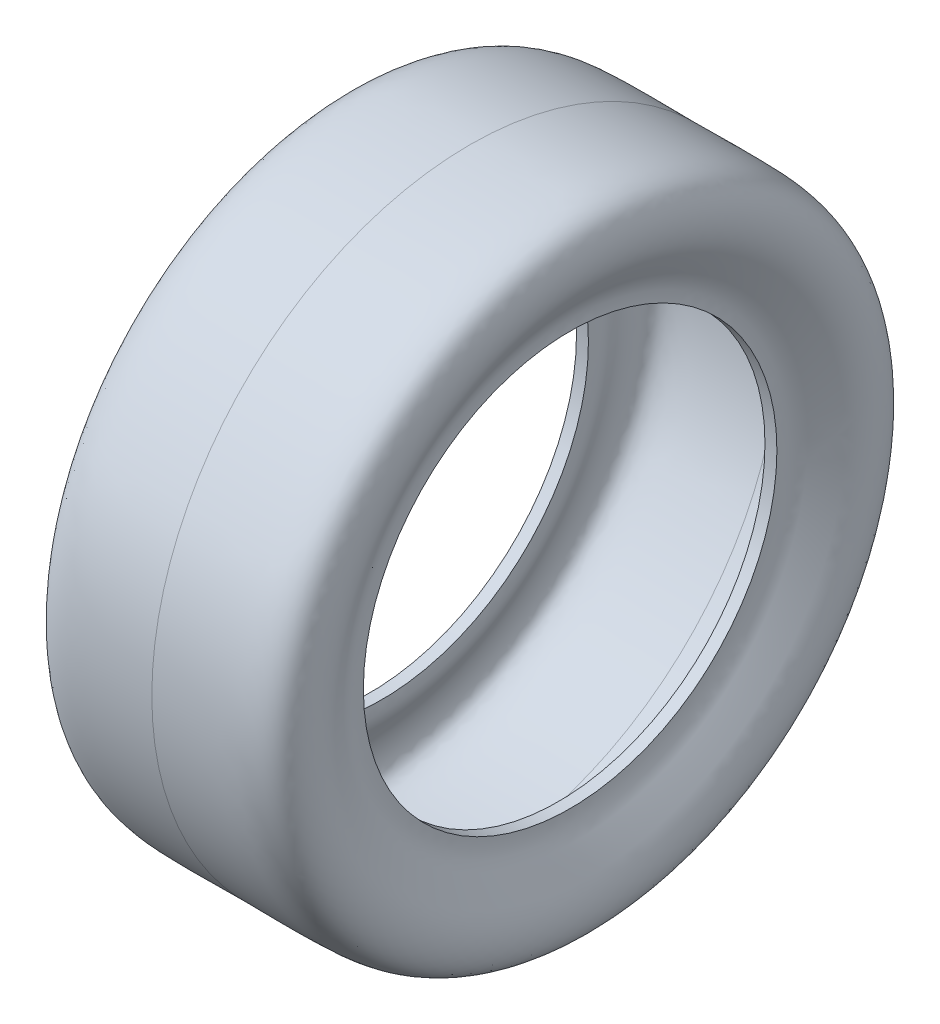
SolidWorks part; units mm, degrees
ref_plane "Front" through (0, 0, 0) normal (0, 0, 1) x (1, 0, 0)
ref_plane "Top" through (0, 0, 0) normal (0, 1, 0) x (1, 0, 0)
ref_plane "Right" through (0, 0, 0) normal (1, 0, 0) x (0, 0, -1)
sketch "Sketch1" plane through (0, 0, 0) normal (0, 0, 1) x (1, 0, 0)
  line L0 (0, 254) -> (0, 47.625) construction
  line L2 (-98.425, 209.55) -> (0, 209.55) construction
  line L3 (0, 209.55) -> (98.425, 209.55) construction
  line L4 (-61.8413, 47.625) -> (188.1587, 47.625) construction
  line L5 (-133.6185, 254) -> (133.6185, 254) construction
  line L6 (-80.01, 165.1) -> (0, 165.1) construction
  line L7 (0, 165.1) -> (80.01, 165.1) construction
  line L8 (-80.01, 165.1) -> (-70.485, 165.1)
  line L9 (70.485, 165.1) -> (80.01, 165.1)
  line L10 (251.6056, 0) -> (0, 0) construction
  line L11 (0, 254) -> (25.4, 254) construction
  line L12 (25.4, 254) -> (25.4, 209.55) construction
  line L13 (25.4, 209.55) -> (25.4, 165.1) construction
  spline_without_curve S0
  spline_without_curve S1
  spline_without_curve S2
  spline_without_curve S3
  dimension "D1" = 196.85
  dimension "D2" = 254
  dimension "D3" = 160.02
  dimension "D4" = 9.525
  dimension "D5" = 9.525
  dimension "D6" = 6.35
  dimension "D7" = 6.35
  dimension "D8" = 6.35
  dimension "D9" = 165.1
  dimension "D10" = 7.9375
  dimension "D11" = 25.4
  dimension "D12" = 2.8177
  dimension "D13" = 3.1293
revolve "Base-Revolve" add sketch "Sketch1" angle 360 about L10
